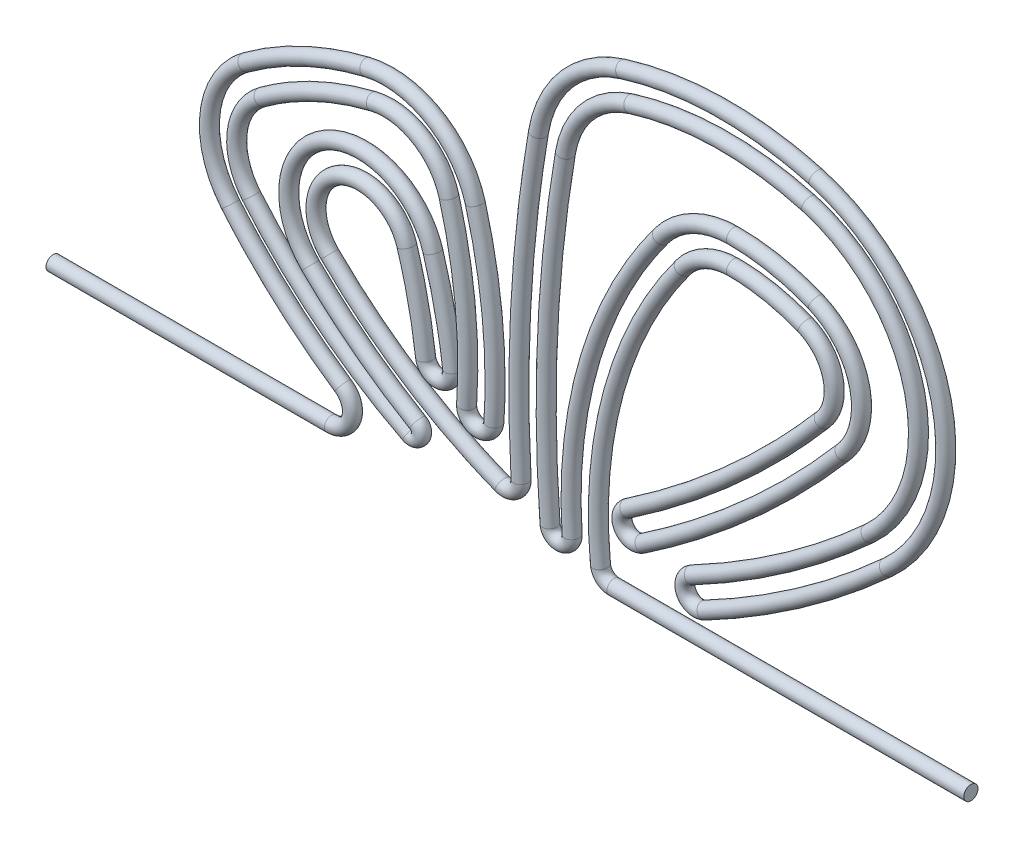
SolidWorks part; units mm, degrees
other "Cámara1"
other "Cámara2"
ref_plane "Alzado" through (0, 0, 0) normal (0, 0, 1) x (1, 0, 0)
ref_plane "Planta" through (0, 0, 0) normal (0, 1, 0) x (1, 0, 0)
ref_plane "Vista lateral" through (0, 0, 0) normal (1, 0, 0) x (0, 0, -1)
sketch "EsquemaBastidor" plane through (0, 0, 0) normal (0, 0, 1) x (1, 0, 0)
  line L0 (792.5, 992.5) -> (-792.5, 992.5)
  line L1 (800, -1000) -> (-800, -1000) construction
  line L2 (800, -1000) -> (800, 1000) construction
  line L3 (800, 1000) -> (-800, 1000) construction
  line L4 (-800, -1000) -> (-800, 1000) construction
  line L5 (800, -1000) -> (-800, 1000) construction
  line L6 (800, 1000) -> (-800, -1000) construction
  line L7 (-792.5, -992.5) -> (-792.5, 992.5)
  line L8 (792.5, -992.5) -> (-792.5, -992.5)
  line L9 (792.5, -992.5) -> (792.5, 992.5)
  line L10 (758.5, 958.5) -> (-758.5, 958.5) construction
  line L11 (-758.5, -958.5) -> (-758.5, 958.5) construction
  line L12 (758.5, -958.5) -> (-758.5, -958.5) construction
  line L13 (758.5, -958.5) -> (758.5, 958.5) construction
  line L14 (748, 948) -> (-748, 948)
  line L15 (-748, -948) -> (-748, 948)
  line L16 (748, -948) -> (-748, -948)
  line L17 (748, -948) -> (748, 948)
  line L18 (500, 1240) -> (2500, 1240) construction
  line L19 (500, 1240) -> (2500, 1240) construction
  line L20 (-751.3215, -1403.0533) -> (-111.9881, -1403.0533) construction
  line L21 (-1842.6407, -1051.9656) -> (-1377.974, -1051.9656) construction
  line L22 (2656.738, 613.7665) -> (3121.4047, 613.7665) construction
  point P0 (0, 0)
  dimension "D1" = 1600
  dimension "D2" = 2000
  dimension "D3" = 7.5
  dimension "D4" = 34
  dimension "D5" = 10.5
sketch "ImagenMotivo_v01" plane through (0, 0, 0) normal (0, 0, 1) x (1, 0, 0)
  line L0 (117, 431) -> (585, 431) construction
ref_plane "PlanoHilo" through (0, 0, 0) normal (0, 0, 1) x (1, 0, 0)
ref_plane "PlanoBastidor" through (0, 0, -6) normal (0, 0, 1) x (1, 0, 0)
ref_plane "PlanoTravesaños" through (0, 0, -12) normal (0, 0, 1) x (1, 0, 0)
sketch "25X15_Bastidor" plane through (0, 0, -6) normal (0, 0, 1) x (1, 0, 0)
  line L0 (792.5, 992.5) -> (-792.5, 992.5) construction
  line L1 (792.5, -992.5) -> (792.5, 992.5) construction
  line L2 (792.5, -992.5) -> (-792.5, -992.5) construction
  line L3 (-792.5, -992.5) -> (-792.5, 992.5) construction
  line L4 (710, 992.5) -> (-710, 992.5)
  line L5 (792.5, -910) -> (792.5, 910)
  line L6 (710, -992.5) -> (-710, -992.5)
  line L7 (-792.5, -910) -> (-792.5, 910)
  arc A0 (-710, -992.5) -> (-792.5, -910) centre (-710, -910) cw
  arc A1 (792.5, -910) -> (710, -992.5) centre (710, -910) cw
  arc A2 (710, 992.5) -> (792.5, 910) centre (710, 910) cw
  arc A3 (-710, 992.5) -> (-792.5, 910) centre (-710, 910) ccw
  dimension "D1" = 82.5
sketch "12X4_BarraHorizontal" plane through (0, 0, 0) normal (0, 0, 1) x (1, 0, 0)
  line L0 (-792.5, 979) -> (792.5, 979)
  line L1 (-792.5, -992.5) -> (-792.5, 992.5) construction
  line L2 (792.5, -992.5) -> (792.5, 992.5) construction
  line L3 (792.5, 992.5) -> (-792.5, 992.5) construction
  line L4 (-643, 992.5) -> (-643, 977.5)
  line L6 (-607, 977.5) -> (-607, 992.5)
  line L7 (607, 992.5) -> (607, 977.5)
  line L8 (643, 977.5) -> (643, 992.5)
  line L9 (-625, 959.5) -> (0, 1000) construction
  line L10 (800, 1000) -> (-800, 1000) construction
  line L11 (0, 1000) -> (625, 959.5) construction
  line L12 (-480.5, 992.5) -> (-480.5, 892.5)
  line L13 (-480.5, 892.5) -> (-357.5, 892.5) construction
  line L16 (-357.5, 992.5) -> (-357.5, 892.5)
  arc A0 (-643, 977.5) -> (-607, 977.5) centre (-625, 977.5) ccw
  arc A1 (607, 977.5) -> (643, 977.5) centre (625, 977.5) ccw
  dimension "D3" = 18
  dimension "D4" = 1250
  dimension "D1" = 13.5
  dimension "D2" = 15
  dimension "D5" = 100
  dimension "D6" = 123
  dimension "D7" = 312
sketch "12X4_Argollas" plane through (0, 0, -12) normal (0, 0, 1) x (1, 0, 0)
  line L0 (607, 992.5) -> (607, 977.5) construction
  line L1 (643, 977.5) -> (643, 992.5) construction
  line L2 (-643, 992.5) -> (-643, 977.5) construction
  line L3 (-607, 977.5) -> (-607, 992.5) construction
  line L4 (607, 992.5) -> (607, 977.5)
  line L5 (643, 977.5) -> (643, 992.5)
  line L6 (-643, 992.5) -> (-643, 977.5)
  line L7 (-607, 977.5) -> (-607, 992.5)
  arc A0 (607, 977.5) -> (643, 977.5) centre (625, 977.5) ccw construction
  arc A1 (-643, 977.5) -> (-607, 977.5) centre (-625, 977.5) ccw construction
  arc A2 (607, 977.5) -> (643, 977.5) centre (625, 977.5) ccw
  arc A3 (-643, 977.5) -> (-607, 977.5) centre (-625, 977.5) ccw
sketch "12X8_CajaConexiones" plane through (0, 0, -12) normal (0, 0, 1) x (1, 0, 0)
  line L0 (-357.5, 992.5) -> (-357.5, 892.5) construction
  line L1 (-480.5, 992.5) -> (-480.5, 892.5) construction
  line L2 (-357.5, 992.5) -> (-357.5, 892.5)
  line L3 (-480.5, 992.5) -> (-480.5, 892.5)
sketch "12X4_BarraH(Recortado)" plane through (0, 0, 0) normal (0, 0, 1) x (1, 0, 0)
  line L0 (-792.5, 979) -> (792.5, 979) construction
  line L1 (-792.5, 979) -> (-643, 979)
  line L2 (-643, 979) -> (-607, 979) construction
  line L3 (-607, 979) -> (-480.5, 979)
  line L4 (-480.5, 979) -> (-357.5, 979) construction
  line L5 (-357.5, 979) -> (607, 979)
  line L6 (607, 979) -> (643, 979) construction
  line L7 (643, 979) -> (792.5, 979)
  line L8 (643, 977.5) -> (643, 992.5) construction
  line L9 (607, 992.5) -> (607, 977.5) construction
  line L10 (-357.5, 992.5) -> (-357.5, 892.5) construction
  line L11 (-480.5, 992.5) -> (-480.5, 892.5) construction
  line L12 (-607, 977.5) -> (-607, 992.5) construction
  line L13 (-643, 992.5) -> (-643, 977.5) construction
sketch "EsquemaPAQUETES" plane through (0, 0, 0) normal (0, 0, 1) x (1, 0, 0)
  line L0 (-748, -193) -> (748, -193)
  line L1 (-748, -948) -> (-748, 948) construction
  line L2 (748, -948) -> (748, 948) construction
  line L3 (-413, -193) -> (-413, -948)
  line L4 (748, -948) -> (-748, -948) construction
  line L5 (-253, -193) -> (-253, -948)
  line L6 (-748, -373) -> (-413, -373)
  line L7 (-253, -373) -> (748, -373)
  line L8 (93, -193) -> (93, 407)
  line L9 (93, 407) -> (693, 407)
  line L10 (693, 407) -> (693, -193)
  line L11 (333, 407) -> (333, -193)
  line L12 (453, 407) -> (453, -193)
  line L13 (393, 367) -> (333, 407) construction
  line L14 (393, 367) -> (453, 407) construction
  line L15 (393, 407) -> (393, -193) construction
  line L16 (-413, -193) -> (-333, -233) construction
  line L17 (-333, -233) -> (-253, -193) construction
  line L18 (-333, -123) -> (-333, -193) construction
  line L19 (393, 407) -> (393, 477) construction
  line L20 (-748, -193) -> (-748, -373)
  line L21 (-748, -373) -> (-748, -948)
  line L22 (-748, -948) -> (-413, -948)
  line L23 (-413, -948) -> (-253, -948)
  line L24 (-253, -948) -> (748, -948)
  line L25 (748, -948) -> (748, -373)
  line L26 (748, -373) -> (748, -193)
  arc A0 (290.5305, 407) -> (495.4695, 407) centre (393, 367) cw
  arc A1 (-435.4695, -193) -> (-230.5305, -193) centre (-333, -233) cw
  dimension "D1" = 600
  dimension "D2" = 110
  dimension "D3" = 120
  dimension "D4" = 180
  dimension "D5" = 755
  dimension "D6" = 415
  dimension "D7" = 160
  dimension "D8" = 70
  dimension "D9" = 55
sketch "EsquemaLAZO-01" plane through (0, 0, 0) normal (0, 0, 1) x (1, 0, 0)
  line L0 (-534.7626, 0.4827) -> (-453.1949, 38.5184) construction
  line L1 (-748, -193) -> (748, -193) construction
  line L2 (-477.074, -16.7518) -> (-493.9788, 19.5006) construction
  line L4 (-204.7683, 126.9707) -> (-105.0744, 80.4827) construction
  line L5 (93, -193) -> (93, 407) construction
  line L6 (93, -193) -> (93, 407) construction
  line L7 (45, -193) -> (45, 407) construction
  line L8 (-136.9617, 70.2563) -> (-87.2356, 75.4827) construction
  arc A0 (-423.8216, -170.9401) -> (-588.4019, -44.4931) centre (-220.5894, 263.9124) cw
  arc A1 (-230.5305, -193) -> (-435.4695, -193) centre (-333, -233) ccw construction
  arc A2 (-588.4019, -44.4931) -> (-576.1866, 56.9101) centre (-534.7626, 0.4827) cw
  arc A3 (-576.1866, 56.9101) -> (-469.794, 106.5218) centre (-398.6552, -184.9216) cw
  arc A4 (-469.794, 106.5218) -> (-385.7871, 57.3913) centre (-453.1949, 38.5184) cw
  arc A5 (-385.7871, 57.3913) -> (-369.4586, -109.2593) centre (-848.0121, -72.0229) cw
  arc A6 (-395.8096, -142.6952) -> (-515.8224, -55.7846) centre (-177.6551, 284.8661) cw
  arc A7 (-515.8224, -55.7846) -> (-424.5325, -0.4917) centre (-477.074, -16.7518) cw
  arc A8 (-45.3757, 39.8072) -> (-66.4195, 126.3914) centre (-87.2356, 75.4827) ccw
  arc A9 (-210.3582, -193) -> (-455.6418, -193) centre (-333, -233) ccw construction
  arc A10 (-424.5325, -0.4917) -> (-403.3956, -124.9007) centre (-883.0766, -142.3977) cw
  arc A11 (-319.8804, -123.7852) -> (-303.3406, 143.8081) centre (928.8136, -66.6584) cw
  arc A12 (-303.3406, 143.8081) -> (-234.5344, 222.4379) centre (-204.7683, 126.9707) cw
  arc A13 (-234.5344, 222.4379) -> (-64.873, 225.0724) centre (-145.236, -63.9636) cw
  arc A14 (-64.873, 225.0724) -> (-3.9709, -30.4244) centre (-105.0744, 80.4827) cw
  arc A15 (-3.9709, -30.4244) -> (-219.8374, -171.0707) centre (-542.9223, 560.7873) cw
  circle A16 centre (-344.7626, -99.5173) radius 24 construction
  arc A17 (-273.2613, -140.635) -> (-193.0762, 112.1033) centre (131.5362, -129.9742) cw
  arc A18 (-193.0762, 112.1033) -> (-136.9617, 140.2563) centre (-136.9617, 70.2563) cw
  arc A19 (-45.3757, 39.8072) -> (-247.8209, -136.1211) centre (-730.3567, 623.5888) cw
  circle A20 centre (-296.6166, -104.0339) radius 24 construction
  circle A22 centre (-211.0149, -140.6494) radius 24 construction
  circle A23 centre (-478.6647, -169) radius 24 construction
  arc A24 (-66.4195, 126.3914) -> (-136.9617, 140.2563) centre (-136.9617, -46.1289) ccw
sketch "EsquemaLAZO-02" plane through (0, 0, 0) normal (0, 0, 1) x (1, 0, 0)
  line L0 (93, 407) -> (693, 407) construction
  line L1 (93, 407) -> (693, 407) construction
  line L2 (93, 455) -> (693, 455) construction
  line L3 (68, 722) -> (203.7367, 768.7379) construction
  line L4 (157.4101, 668.1767) -> (239.914, 696.5851) construction
  line L5 (511.3044, 665.714) -> (613, 607) construction
  line L7 (623.7524, 642) -> (393, 367) construction
  arc A0 (299.4523, 424.869) -> (-9.9317, 659.337) centre (613.5219, 1160.6409) cw
  arc A1 (495.4695, 407) -> (290.5305, 407) centre (393, 367) ccw construction
  arc A2 (-9.9317, 659.337) -> (3.9665, 798.8096) centre (68, 722) cw
  arc A3 (3.9665, 798.8096) -> (192.5777, 878.1704) centre (228.0837, 529.976) cw
  arc A4 (192.5777, 878.1704) -> (306.2829, 808.5408) centre (203.7367, 768.7379) cw
  arc A5 (306.2829, 808.5408) -> (359.0854, 471.6413) centre (-439.5077, 519.065) cw
  arc A7 (108.5603, 633.3384) -> (116.373, 711.9483) centre (157.4101, 668.1767) cw
  arc A10 (545.8529, 407) -> (240.1471, 407) centre (393, 367) ccw construction
  arc A12 (318.4973, 447.9281) -> (108.5603, 633.3384) centre (613.3409, 993.3337) cw
  arc A13 (226.4367, 716.3637) -> (318.3539, 506.255) centre (-958.4994, 72.8245) cw
  circle A14 centre (333.8479, 541.5675) radius 26.3171 construction
  arc A16 (524.225, 455) -> (673.4078, 540.285) centre (404.9287, 836.7963) ccw
  arc A17 (673.4078, 540.285) -> (671.712, 675.2122) centre (613, 607) ccw
  arc A18 (671.712, 675.2122) -> (512.3471, 735.7062) centre (508.6231, 485.734) ccw
  arc A19 (512.3471, 735.7062) -> (448.2928, 696.2022) centre (511.3044, 665.714) ccw
  arc A20 (448.2928, 696.2022) -> (411.0687, 475.5059) centre (808.3593, 521.9837) ccw
  arc A21 (430.3907, 470.4502) -> (460.8781, 623.3505) centre (830.3906, 470.1822) cw
  arc A23 (591.4153, 560.9307) -> (501.6839, 481.6814) centre (217.9442, 893.3752) cw
  arc A27 (149.6082, 737.1567) -> (226.4367, 716.3637) centre (178.1047, 690.1146) cw
  arc A28 (116.373, 711.9483) -> (149.6082, 737.1567) centre (253.4451, 565.7422) cw
  arc A29 (460.8781, 623.3505) -> (506.4014, 657.0354) centre (511.6861, 602.2898) cw
  arc A30 (506.4014, 657.0354) -> (568.824, 649.2983) centre (520.2765, 513.2991) cw
  arc A31 (568.824, 649.2983) -> (591.4153, 560.9307) centre (550.3335, 597.4996) cw
  point P40 (360.4882, 521.6188)
sketch "EsquemaHILO" plane through (0, 0, 0) normal (0, 0, 1) x (1, 0, 0)
  line L0 (-748, -948) -> (-722.1906, -922.1906) construction
  line L1 (-748, -896.3812) -> (-696.3812, -948) construction
  line L2 (80.5, -180.5) -> (-246.494, -180.5)
  line L3 (320.5, 359) -> (465.5, 359) construction
  line L4 (-748, -193) -> (748, -193) construction
  line L5 (320.5, -180.5) -> (105.5, -180.5)
  line L6 (-400.5, -960.5) -> (-400.5, -193)
  line L7 (-760.5, -960.5) -> (-400.5, -960.5)
  line L8 (-760.5, -373) -> (-760.5, -960.5)
  line L9 (-400.5, -935.5) -> (-400.5, -266)
  line L10 (-696.3812, -960.5) -> (0, -960.5)
  line L11 (-760.5, -385.5) -> (-760.5, -896.3812)
  line L12 (-425.5, -935.5) -> (-425.5, -193)
  line L13 (-735.5, -935.5) -> (-425.5, -935.5)
  line L14 (-735.5, -373) -> (-735.5, -935.5)
  line L15 (-425.5, -935.5) -> (-425.5, -385.5)
  line L16 (-696.3812, -935.5) -> (-425.5, -935.5)
  line L17 (-735.5, -385.5) -> (-735.5, -896.3812)
  line L18 (440.5, -180.5) -> (345.5, -180.5)
  line L20 (-425.5, -360.5) -> (-425.5, -266)
  line L21 (-240.5, -385.5) -> (-240.5, -935.5)
  line L22 (-400.5, -935.5) -> (-265.5, -935.5)
  line L23 (-265.5, -193) -> (-265.5, -960.5)
  line L24 (-265.5, -960.5) -> (760.5, -960.5)
  line L25 (760.5, -960.5) -> (760.5, -373)
  line L26 (-265.5, -266) -> (-265.5, -935.5)
  line L27 (0, -960.5) -> (760.5, -960.5)
  line L28 (760.5, -960.5) -> (760.5, -385.5)
  line L29 (-240.5, -193) -> (-240.5, -935.5)
  line L30 (-240.5, -935.5) -> (735.5, -935.5)
  line L31 (735.5, -935.5) -> (735.5, -373)
  line L32 (-240.5, -266) -> (-240.5, -360.5)
  line L33 (-240.5, -935.5) -> (735.5, -935.5)
  line L34 (735.5, -935.5) -> (735.5, -360.5)
  line L35 (-425.5, -266) -> (-240.5, -266) construction
  line L36 (-748, -373) -> (-748, -948) construction
  line L37 (-748, -948) -> (-413, -948) construction
  line L38 (-505.4139, -180.5) -> (-760.5, -180.5)
  line L40 (440.5, 407) -> (440.5, -193)
  line L41 (440.5, 359) -> (440.5, -180.5)
  line L42 (465.5, 407) -> (465.5, -193)
  line L43 (465.5, 359) -> (465.5, -180.5)
  line L45 (320.5, 407) -> (320.5, -193)
  line L46 (320.5, 359) -> (320.5, -180.5)
  line L47 (345.5, 407) -> (345.5, -193)
  line L48 (345.5, 359) -> (345.5, -180.5)
  line L56 (680.5, 394.5) -> (680.5, -193)
  line L57 (105.5, 394.5) -> (680.5, 394.5)
  line L58 (105.5, -193) -> (105.5, 394.5)
  line L59 (680.5, 394.5) -> (680.5, -145)
  line L60 (105.5, 394.5) -> (680.5, 394.5)
  line L61 (105.5, -180.5) -> (105.5, 394.5)
  line L62 (705.5, 419.5) -> (705.5, -193)
  line L63 (80.5, 419.5) -> (705.5, 419.5)
  line L64 (80.5, -193) -> (80.5, 419.5)
  line L65 (705.5, 419.5) -> (705.5, -145)
  line L67 (80.5, -180.5) -> (80.5, 419.5)
  line L182 (760.5, -385.5) -> (760.5, -180.5)
  line L183 (-253, -385.5) -> (760.5, -385.5)
  line L184 (-760.5, -385.5) -> (-413, -385.5)
  line L185 (-760.5, -180.5) -> (-760.5, -385.5)
  line L186 (760.5, -180.5) -> (-760.5, -180.5)
  line L187 (760.5, -385.5) -> (760.5, -180.5)
  line L188 (-240.5, -385.5) -> (700, -385.5)
  line L189 (-735.5, -385.5) -> (-425.5, -385.5)
  line L190 (-760.5, -180.5) -> (-760.5, -385.5)
  line L191 (760.5, -180.5) -> (465.5, -180.5)
  line L192 (735.5, -360.5) -> (735.5, -205.5)
  line L193 (-253, -360.5) -> (735.5, -360.5)
  line L194 (-735.5, -360.5) -> (-413, -360.5)
  line L195 (-735.5, -205.5) -> (-735.5, -360.5)
  line L196 (735.5, -205.5) -> (-735.5, -205.5)
  line L197 (735.5, -360.5) -> (735.5, -205.5)
  line L198 (-240.5, -360.5) -> (700, -360.5)
  line L199 (-735.5, -360.5) -> (-425.5, -360.5)
  line L200 (-735.5, -205.5) -> (-735.5, -360.5)
  line L201 (735.5, -205.5) -> (-735.5, -205.5)
  arc A0 (-696.3812, -960.5) -> (-696.3812, -935.5) centre (-696.3812, -948) cw
  arc A1 (-760.5, -896.3812) -> (-735.5, -896.3812) centre (-748, -896.3812) ccw
  circle A2 centre (-722.1906, -922.1906) radius 24 construction
  arc A3 (-425.5, -266) -> (-400.5, -266) centre (-413, -266) cw
  arc A4 (-265.5, -266) -> (-240.5, -266) centre (-253, -266) cw
  arc A5 (320.5, 359) -> (345.5, 359) centre (333, 359) cw
  arc A6 (440.5, 359) -> (465.5, 359) centre (453, 359) cw
  arc A7 (680.5, -145) -> (705.5, -145) centre (693, -145) ccw
  arc A8 (700, -360.5) -> (700, -385.5) centre (700, -373) cw
  arc A9 (-331.6765, -137.8698) -> (-348.7308, -150.2079) centre (-344.1566, -138.5749) cw
  arc A10 (-494.6999, -145.2571) -> (-505.4139, -180.5) centre (-505.4139, -161.25) cw
  arc A11 (-258.9312, -169.2511) -> (-246.494, -180.5) centre (-246.494, -168) ccw
  arc A13 (-233.8145, -112.0076) -> (-219.8274, -132.7286) centre (-226.821, -122.3681) ccw
  arc A15 (-247.8209, -136.1211) -> (-45.3757, 39.8072) centre (-730.3567, 623.5888) ccw construction
  arc A16 (-432.9992, -152.5469) -> (-426.2849, -140.2686) centre (-429.8187, -146.3111) ccw
  circle A17 centre (-429.8187, -146.3111) radius 34 construction
  arc A18 (-305.179, -159.7634) -> (-284.9388, -158.3112) centre (-295.0616, -159) ccw
  arc A19 (-356.9963, -110.229) -> (-373.75, 60.7614) centre (-848.0121, -72.0229) ccw
  arc A20 (-373.75, 60.7614) -> (-472.7581, 118.6653) centre (-453.1949, 38.5184) ccw
  arc A21 (-472.7581, 118.6653) -> (-583.5838, 66.9865) centre (-398.6552, -184.9216) ccw
  arc A22 (-583.5838, 66.9865) -> (-597.9804, -52.5245) centre (-534.7626, 0.4827) ccw
  arc A23 (-597.9804, -52.5245) -> (-429.1141, -182.2643) centre (-220.5894, 263.9124) ccw
  arc A24 (-356.6116, -104.9126) -> (-373.75, 60.7614) centre (-848.0121, -72.0229) ccw
  arc A25 (-373.75, 60.7614) -> (-472.7581, 118.6653) centre (-453.1949, 38.5184) ccw
  arc A26 (-472.7581, 118.6653) -> (-583.5838, 66.9865) centre (-398.6552, -184.9216) ccw
  arc A27 (-583.5838, 66.9865) -> (-597.9804, -52.5245) centre (-534.7626, 0.4827) ccw
  arc A28 (-597.9804, -52.5245) -> (-494.6999, -145.2571) centre (-220.5894, 263.9124) ccw
  arc A29 (-381.9209, -108.2896) -> (-397.8242, 54.0211) centre (-848.0121, -72.0229) ccw
  arc A30 (-397.8242, 54.0211) -> (-466.8299, 94.3784) centre (-453.1949, 38.5184) ccw
  arc A31 (-466.8299, 94.3784) -> (-568.7895, 46.8338) centre (-398.6552, -184.9216) ccw
  arc A32 (-568.7895, 46.8338) -> (-578.8235, -36.4617) centre (-534.7626, 0.4827) ccw
  arc A33 (-578.8235, -36.4617) -> (-418.5291, -159.6158) centre (-220.5894, 263.9124) ccw
  arc A34 (-381.5557, -103.2431) -> (-397.8242, 54.0211) centre (-848.0121, -72.0229) ccw
  arc A35 (-397.8242, 54.0211) -> (-466.8299, 94.3784) centre (-453.1949, 38.5184) ccw
  arc A36 (-466.8299, 94.3784) -> (-568.7895, 46.8338) centre (-398.6552, -184.9216) ccw
  arc A37 (-568.7895, 46.8338) -> (-578.8235, -36.4617) centre (-534.7626, 0.4827) ccw
  arc A38 (-578.8235, -36.4617) -> (-432.9992, -152.5469) centre (-220.5894, 263.9124) ccw
  circle A39 centre (-295.0616, -159) radius 34 construction
  circle A41 centre (-226.821, -122.3681) radius 34 construction
  arc A42 (-174.9389, -135.4486) -> (-163.2569, -157.5514) centre (-169.0979, -146.5) ccw
  arc A43 (-390.9039, -124.4451) -> (-412.5913, 3.2038) centre (-883.0766, -142.3977) ccw
  arc A44 (-524.6288, -64.6558) -> (-401.4907, -153.8296) centre (-177.6551, 284.8661) ccw
  arc A45 (-412.5913, 3.2038) -> (-524.6288, -64.6558) centre (-477.074, -16.7518) ccw
  arc A46 (-394.3422, -81.612) -> (-412.5913, 3.2038) centre (-883.0766, -142.3977) ccw
  arc A47 (-524.6288, -64.6558) -> (-426.2849, -140.2686) centre (-177.6551, 284.8661) ccw
  arc A48 (-412.5913, 3.2038) -> (-524.6288, -64.6558) centre (-477.074, -16.7518) ccw
  arc A49 (-416.2583, -117.1597) -> (-436.4738, -4.1872) centre (-883.0766, -142.3977) ccw
  arc A50 (-507.0159, -46.9135) -> (-416.2583, -117.1597) centre (-177.6551, 284.8661) ccw
  arc A51 (-436.4738, -4.1872) -> (-507.0159, -46.9135) centre (-477.074, -16.7518) ccw
  arc A52 (-419.151, -84.6976) -> (-436.4738, -4.1872) centre (-883.0766, -142.3977) ccw
  arc A53 (-507.0159, -46.9135) -> (-348.7308, -150.2079) centre (-177.6551, 284.8661) ccw
  arc A54 (-436.4738, -4.1872) -> (-507.0159, -46.9135) centre (-477.074, -16.7518) ccw
  circle A55 centre (-169.0979, -146.5) radius 34 construction
  arc A56 (-381.5557, -103.2431) -> (-356.6116, -104.9126) centre (-369.0836, -104.0778) ccw
  circle A57 centre (-369.0836, -104.0778) radius 34 construction
  arc A58 (-419.151, -84.6976) -> (-394.3422, -81.612) centre (-406.7466, -83.1548) ccw
  circle A59 centre (-406.7466, -83.1548) radius 34 construction
  arc A72 (-214.7892, -182.506) -> (4.4502, -39.6621) centre (-542.9223, 560.7873) ccw
  arc A73 (4.4502, -39.6621) -> (-61.5245, 237.1156) centre (-105.0744, 80.4827) ccw
  arc A74 (-61.5245, 237.1156) -> (-238.2552, 234.3713) centre (-145.236, -63.9636) ccw
  arc A75 (-238.2552, 234.3713) -> (-315.6621, 145.9127) centre (-204.7683, 126.9707) ccw
  arc A76 (-315.6621, 145.9127) -> (-332.3673, -124.3565) centre (928.8136, -66.6584) ccw
  arc A77 (-163.2569, -157.5514) -> (4.4502, -39.6621) centre (-542.9223, 560.7873) ccw
  arc A78 (4.4502, -39.6621) -> (-61.5245, 237.1156) centre (-105.0744, 80.4827) ccw
  arc A79 (-61.5245, 237.1156) -> (-238.2552, 234.3713) centre (-145.236, -63.9636) ccw
  arc A80 (-238.2552, 234.3713) -> (-315.6621, 145.9127) centre (-204.7683, 126.9707) ccw
  arc A81 (-315.6621, 145.9127) -> (-331.6765, -137.8698) centre (928.8136, -66.6584) ccw
  arc A82 (-224.8856, -159.6354) -> (-12.392, -21.1868) centre (-542.9223, 560.7873) ccw
  arc A83 (-12.392, -21.1868) -> (-68.2214, 213.0292) centre (-105.0744, 80.4827) ccw
  arc A84 (-68.2214, 213.0292) -> (-230.8136, 210.5045) centre (-145.236, -63.9636) ccw
  arc A85 (-230.8136, 210.5045) -> (-291.019, 141.7034) centre (-204.7683, 126.9707) ccw
  arc A86 (-291.019, 141.7034) -> (-307.3934, -123.2139) centre (928.8136, -66.6584) ccw
  arc A87 (-174.9389, -135.4486) -> (-12.392, -21.1868) centre (-542.9223, 560.7873) ccw
  arc A88 (-12.392, -21.1868) -> (-68.2214, 213.0292) centre (-105.0744, 80.4827) ccw
  arc A89 (-68.2214, 213.0292) -> (-230.8136, 210.5045) centre (-145.236, -63.9636) ccw
  arc A90 (-230.8136, 210.5045) -> (-291.019, 141.7034) centre (-204.7683, 126.9707) ccw
  arc A91 (-291.019, 141.7034) -> (-305.179, -159.7634) centre (928.8136, -66.6584) ccw
  arc A121 (-241.119, -146.6726) -> (-35.8621, 31.6991) centre (-730.3567, 623.5888) ccw
  arc A122 (-35.8621, 31.6991) -> (-61.6885, 137.9615) centre (-87.2356, 75.4827) ccw
  arc A123 (-61.6885, 137.9615) -> (-136.9617, 152.7563) centre (-136.9617, -46.1289) ccw
  arc A124 (-136.9617, 152.7563) -> (-203.0966, 119.5759) centre (-136.9617, 70.2563) ccw
  arc A125 (-203.0966, 119.5759) -> (-285.757, -140.9641) centre (131.5362, -129.9742) ccw
  arc A126 (-219.8274, -132.7286) -> (-35.8621, 31.6991) centre (-730.3567, 623.5888) ccw
  arc A127 (-35.8621, 31.6991) -> (-61.6885, 137.9615) centre (-87.2356, 75.4827) ccw
  arc A128 (-61.6885, 137.9615) -> (-136.9617, 152.7563) centre (-136.9617, -46.1289) ccw
  arc A129 (-136.9617, 152.7563) -> (-203.0966, 119.5759) centre (-136.9617, 70.2563) ccw
  arc A130 (-203.0966, 119.5759) -> (-284.9388, -158.3112) centre (131.5362, -129.9742) ccw
  arc A131 (-254.5228, -125.5696) -> (-54.8893, 47.9153) centre (-730.3567, 623.5888) ccw
  arc A132 (-54.8893, 47.9153) -> (-71.1504, 114.8212) centre (-87.2356, 75.4827) ccw
  arc A133 (-71.1504, 114.8212) -> (-136.9617, 127.7563) centre (-136.9617, -46.1289) ccw
  arc A134 (-136.9617, 127.7563) -> (-183.0557, 104.6306) centre (-136.9617, 70.2563) ccw
  arc A135 (-183.0557, 104.6306) -> (-260.7657, -140.3059) centre (131.5362, -129.9742) ccw
  arc A136 (-233.8145, -112.0076) -> (-54.8893, 47.9153) centre (-730.3567, 623.5888) ccw
  arc A137 (-54.8893, 47.9153) -> (-71.1504, 114.8212) centre (-87.2356, 75.4827) ccw
  arc A138 (-71.1504, 114.8212) -> (-136.9617, 127.7563) centre (-136.9617, -46.1289) ccw
  arc A139 (-136.9617, 127.7563) -> (-183.0557, 104.6306) centre (-136.9617, 70.2563) ccw
  arc A140 (-183.0557, 104.6306) -> (-258.9312, -169.2511) centre (131.5362, -129.9742) ccw
  point P203 (0, 0)
other "Hilo HILO_BLANCO_CALIDO(15)"
ref_plane "Plano3" through (80.5, -180.5, 0) normal (-1, 0, 0) x (0, -1, 0)
sketch "Croquis21" plane through (80.5, -180.5, 0) normal (-1, 0, 0) x (0, -1, 0)
  circle A0 centre (0, 0) radius 6.5
  point P3 (0, 6.5)
  point P4 (-6.5, 0)
  point P5 (0, -6.5)
  point P6 (6.5, 0)
  point P7 (-6.5, 6.5)
  point P8 (6.5, 6.5)
  point P9 (6.5, -6.5)
  point P10 (-6.5, -6.5)
  point P11 (0, 0)
  dimension "D1" = 13
equation "\"Equidis_HILO\"= 12.5'6mm mitad de perfil + 6,5mm mitad del hilo LED"
equation "\"D1@EsquemaHILO\" = \"Equidis_HILO\""
equation "\"D2@EsquemaHILO\" = \"Equidis_HILO\""
equation "\"D4@EsquemaHILO\" = \"Equidis_HILO\""
equation "\"D3@EsquemaHILO\" = \"Equidis_HILO\""
equation "\"D5@EsquemaHILO\" = \"Equidis_HILO\""
equation "\"D6@EsquemaHILO\" = \"Equidis_HILO\""
equation "\"D7@EsquemaHILO\" = \"Equidis_HILO\""
equation "\"D8@EsquemaHILO\" = \"Equidis_HILO\""
equation "\"D9@EsquemaHILO\"=\"Equidis_HILO\""
equation "\"D10@EsquemaHILO\"=\"Equidis_HILO\""
equation "\"D11@EsquemaHILO\"=\"Equidis_HILO\""
equation "\"D12@EsquemaHILO\"=\"Equidis_HILO\""
equation "\"D14@EsquemaHILO\"=\"Equidis_HILO\""
equation "\"D13@EsquemaHILO\"=\"Equidis_HILO\""
equation "\"Equidis_MinHolgura\"= 48'6mm mitad de perfil +13mm de HILO + 10mm de holgura +13 mm + 6 mm"
equation "\"D15@EsquemaHILO\"=\"Equidis_MinHolgura\"+\"Radio_MinHilo\""
equation "\"D16@EsquemaHILO\"=\"Equidis_MinHolgura\""
equation "\"Radio_MinHilo\"= 12.5'Radio a eje del mínimo lazo que se puede generar con el Hilo LED"
equation "\"D18@EsquemaHILO\"=\"Equidis_HILO\""
equation "\"D19@EsquemaHILO\"=\"Equidis_HILO\""
equation "\"D21@EsquemaHILO\"=\"Equidis_HILO\""
equation "\"D20@EsquemaHILO\"=\"Equidis_HILO\""
equation "\"D22@EsquemaHILO\"=\"Equidis_HILO\""
equation "\"D23@EsquemaHILO\"=\"Equidis_HILO\""
equation "\"Holgura_Min\"= 10'Holgura mínima a respetar entre dos hilos consecutivos (por montaje)"
equation "\"D25@EsquemaHILO\"=\"Holgura_Min\"+\"Diam_HILO\""
equation "\"Diam_HILO\"= 13mm'Diámetro nominal del hilo LED"
equation "\"D24@EsquemaHILO\"=\"Holgura_Min\"+\"Diam_HILO\""
equation "\"D26@EsquemaHILO\"=\"Holgura_Min\"+\"Diam_HILO\""
equation "\"D27@EsquemaHILO\"=\"Equidis_HILO\""
equation "\"D29@EsquemaHILO\"=\"Diam_HILO\"+(\"Radio_MinHilo\"*0.5)"
equation "\"D31@EsquemaHILO\"=\"Radio_MinHilo\""
equation "\"D32@EsquemaHILO\"=\"Equidis_MinHolgura\"+(\"Holgura_Min\"*2)"
equation "\"D19@EsquemaLAZO-01\"=\"Equidis_MinHolgura\""
equation "\"Rgmin\"=55"
equation "\"D14@EsquemaLAZO-01\"=\"Rgmin\""
equation "\"D18@EsquemaLAZO-02\"=\"Rgmin\""
